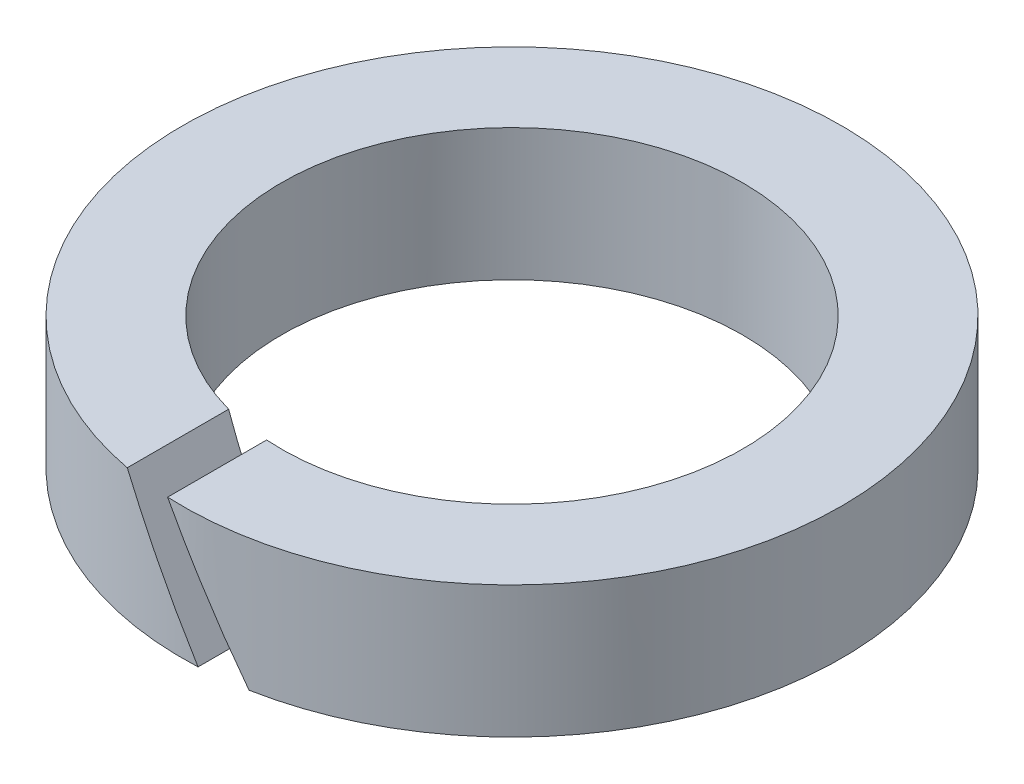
SolidWorks part; units mm, degrees
ref_plane "Base 1" through (0, 0, 0) normal (0, 0, 1) x (1, 0, 0)
ref_plane "Face" through (0, 0, 0) normal (0, 1, 0) x (1, 0, 0)
ref_plane "Base 2" through (0, 0, 0) normal (1, 0, 0) x (0, 0, -1)
sketch "section" plane through (0, 0, 0) normal (0, 0, 1) x (1, 0, 0)
  line L0 (3.5, 1) -> (5, 1)
  line L1 (3.5, 1) -> (3.5, -1)
  line L2 (5, -1) -> (3.5, -1)
  line L3 (5, -1) -> (5, 1)
  line L4 (0, 80) -> (0, -70) construction
  line L5 (5, 0) -> (3.5, 0) construction
  line L6 (50, 0) -> (-50, 0) construction
  dimension "A" = 3.5
  dimension "B" = 5
  dimension "C" = 2
revolve "Révolution" add sketch "section" angle 360 about L4
sketch "Sketch2" plane through (0, 0.6, 0) normal (0, 0, -1) x (-1, 0, 0)
  line L0 (1.4577, 1.9249) -> (-1.4577, -3.1249) construction
  line L1 (0, 49.4) -> (0, -50.6) construction
  line L2 (-0.9238, -1.6) -> (0.2309, 0.4)
  line L3 (-0.2309, -1.6) -> (0.9238, 0.4)
  line L4 (0.9238, 0.4) -> (0.2309, 0.4)
  line L5 (-0.2309, -1.6) -> (-0.9238, -1.6)
  line L6 (-5, -1.6) -> (5, -1.6) construction
  line L7 (-5, 0.4) -> (5, 0.4) construction
  dimension "D1" = 30
  dimension "K1" = 0.6
extrude "fente" cut sketch "Sketch2" against normal up to next
